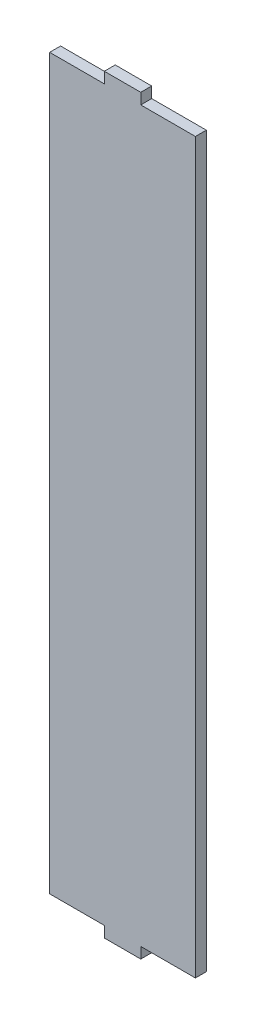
SolidWorks part; units mm, degrees
ref_plane "Front Plane" through (0, 0, 0) normal (0, 0, 1) x (1, 0, 0)
ref_plane "Top Plane" through (0, 0, 0) normal (0, 1, 0) x (1, 0, 0)
ref_plane "Right Plane" through (0, 0, 0) normal (1, 0, 0) x (0, 0, -1)
sketch "Sketch1" plane through (0, 0, 0) normal (0, 0, 1) x (1, 0, 0)
  line L0 (-13.4615, 90.7829) -> (-13.4615, 130.1889) construction
  line L1 (-33.4615, 190.7829) -> (-18.4615, 190.7829)
  line L2 (-33.4615, 190.7829) -> (-33.4615, -9.2171)
  line L3 (-33.4615, -9.2171) -> (-18.4615, -9.2171)
  line L4 (6.5385, 190.7829) -> (6.5385, -9.2171)
  line L5 (-33.4615, 190.7829) -> (6.5385, -9.2171) construction
  line L6 (-33.4615, -9.2171) -> (6.5385, 190.7829) construction
  line L7 (-8.4615, 190.7829) -> (6.5385, 190.7829)
  line L8 (-8.4615, -9.2171) -> (6.5385, -9.2171)
  line L9 (-18.4615, 190.7829) -> (-18.4615, 193.7829)
  line L10 (-18.4615, 193.7829) -> (-8.4615, 193.7829)
  line L11 (-8.4615, 190.7829) -> (-8.4615, 193.7829)
  line L12 (-13.4615, 192.0629) -> (-8.4615, 193.7829) construction
  line L13 (-18.4615, 193.7829) -> (-13.2084, 193.1805) construction
  line L15 (-18.4615, -9.2171) -> (-18.4615, -12.2171)
  line L16 (-18.4615, -12.2171) -> (-8.4615, -12.2171)
  line L17 (-8.4615, -9.2171) -> (-8.4615, -12.2171)
  line L18 (-20.0428, -6.5611) -> (-8.4615, -12.2171) construction
  line L19 (-18.4615, -12.2171) -> (-12.66, -5.2829) construction
  point P0 (-13.4615, 90.7829)
  point P7 (-10.9615, 192.9229)
  point P14 (-15.5608, -8.75)
  dimension "D1" = 40
  dimension "D2" = 200
  dimension "D3" = 10
  dimension "D4" = 15
  dimension "D5" = 3
  dimension "D6" = 10
  dimension "D7" = 15
  dimension "D8" = 3
extrude "Boss-Extrude1" add sketch "Sketch1" along normal blind 3 contours L4 L8 L17 L16 L15 L3 L2 L1 L9 L10 L11 L7
equation "\"thickness of material\"= 4mm"
equation "\"Length\"= 120mm"
equation "\"width\"= 60mm"
equation "\"length of strip\"= 60mm"
equation "\"width of strip\"= 10mm"
equation "\"D1@Boss-Extrude1\"=\"thickness of material\""
